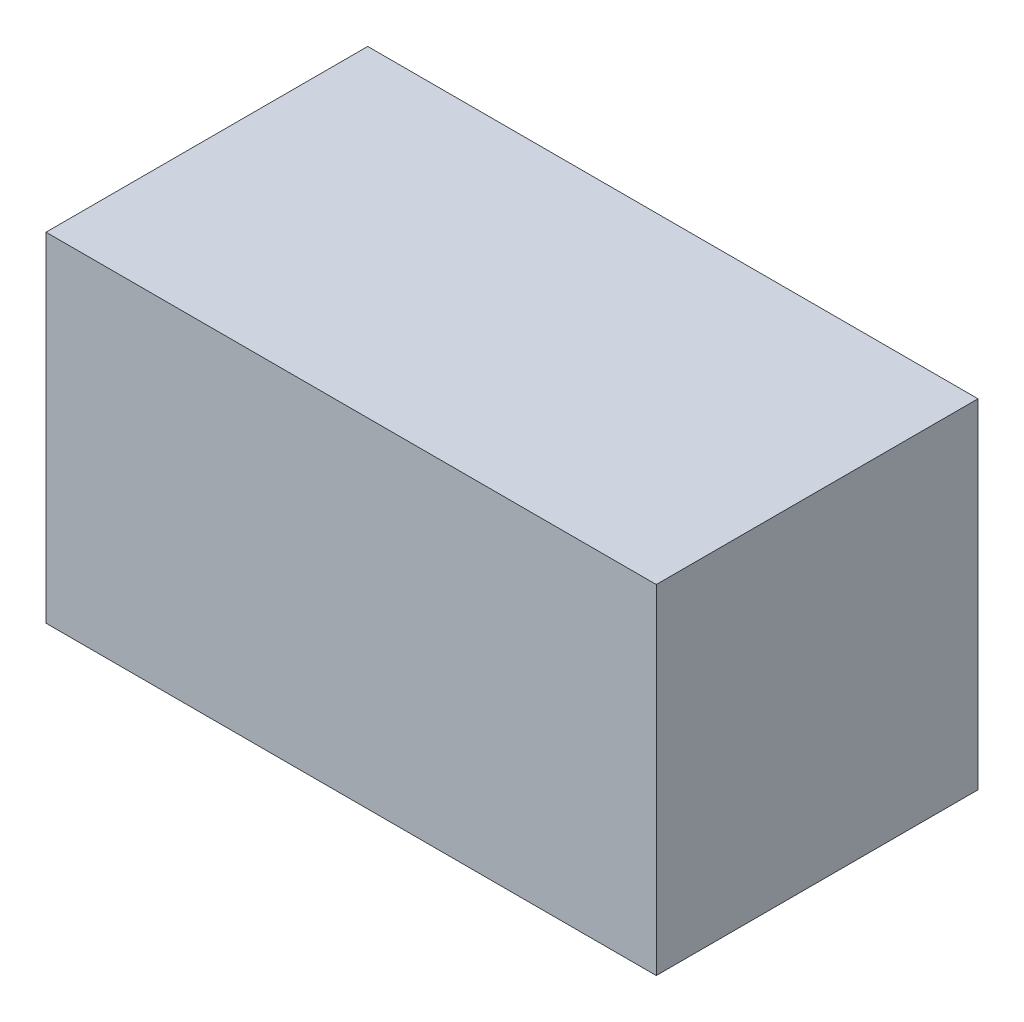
SolidWorks part; units mm, degrees
ref_plane "Front Plane" through (0, 0, 0) normal (0, 0, 1) x (1, 0, 0)
ref_plane "Top Plane" through (0, 0, 0) normal (0, 1, 0) x (1, 0, 0)
ref_plane "Right Plane" through (0, 0, 0) normal (1, 0, 0) x (0, 0, -1)
sketch "Sketch1" plane through (0, 0, 0) normal (0, 1, 0) x (1, 0, 0)
  line L1 (0, 0) -> (18.02, 0)
  line L2 (0, 0) -> (0, -9.5)
  line L3 (0, -9.5) -> (18.02, -9.5)
  line L4 (18.02, 0) -> (18.02, -9.5)
  point P4 (0, 0)
  dimension "D1" = 18.02
  dimension "D2" = 9.5
extrude "Boss-Extrude1" add sketch "Sketch1" along normal blind 10
